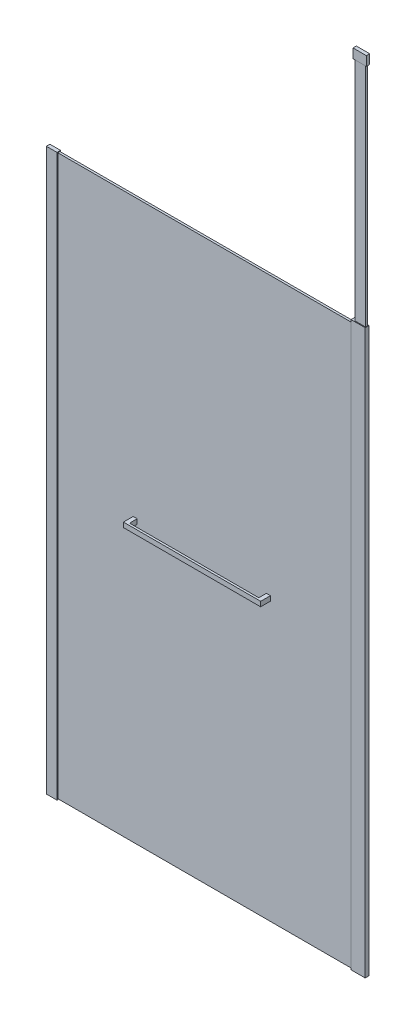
SolidWorks part; units mm, degrees
ref_plane "Płaszczyzna przednia" through (0, 0, 0) normal (0, 0, 1) x (1, 0, 0)
ref_plane "Płaszczyzna górna" through (0, 0, 0) normal (0, 1, 0) x (1, 0, 0)
ref_plane "Płaszczyzna prawa" through (0, 0, 0) normal (1, 0, 0) x (0, 0, -1)
sketch "Szkic1" plane through (0, 0, 0) normal (0, 1, 0) x (1, 0, 0)
  line L0 (0, 0) -> (0, 13.3)
  line L1 (0, 13.3) -> (40, 13.3)
  line L2 (40, 13.3) -> (40, 11.4)
  line L3 (40, 11.4) -> (6.5, 11.4)
  line L4 (6.5, 11.4) -> (6.5, 3.4)
  line L5 (6.5, 3.4) -> (40, 3.4)
  line L6 (40, 3.4) -> (40, 0)
  line L7 (40, 0) -> (0, 0)
  dimension "D1" = 40
  dimension "D2" = 13.3
  dimension "D3" = 33.5
  dimension "D4" = 1.9
  dimension "D5" = 8
extrude "Dodanie-wyciągnięcie1" add sketch "Szkic1" along normal blind 2100 from offset 3
sketch "Szkic2" plane through (0, 3, 0) normal (0, -1, 0) x (1, 0, 0)
  line L0 (6.5, -11.4) -> (40, -11.4) construction
  line L1 (6.5, -3.4) -> (1153.5, -3.4)
  line L2 (6.5, -3.4) -> (6.5, -11.4)
  line L3 (6.5, -11.4) -> (1153.5, -11.4)
  line L4 (1153.5, -3.4) -> (1153.5, -11.4)
  dimension "D1" = 1147
extrude "Dodanie-wyciągnięcie2" add sketch "Szkic2" against normal blind 2100 separate body
sketch "Szkic3" plane through (0, 3, 0) normal (0, -1, 0) x (1, 0, 0)
  line L0 (1143.4, -3.4) -> (1143.4, -0.4)
  line L1 (1153.5, -3.4) -> (6.5, -3.4) construction
  line L2 (1143.4, -0.4) -> (1196.4, -0.4)
  line L3 (1196.4, -0.4) -> (1196.4, -14.4)
  line L4 (1196.4, -14.4) -> (1143.4, -14.4)
  line L5 (1143.4, -14.4) -> (1143.4, -11.4)
  line L6 (1143.4, -11.4) -> (1153.5, -11.4)
  line L7 (1153.5, -11.4) -> (1153.5, -3.4)
  line L8 (1153.5, -3.4) -> (1143.4, -3.4)
  line L9 (6.5, -11.4) -> (1153.5, -11.4) construction
  line L10 (1153.5, -11.4) -> (1153.5, -3.4) construction
  dimension "D1" = 10.1
  dimension "D2" = 3
  dimension "D3" = 3
  dimension "D4" = 53
extrude "Dodanie-wyciągnięcie3" add sketch "Szkic3" against normal blind 2108 separate body
sketch "Szkic4" plane through (0, 2103, 0) normal (0, 1, 0) x (1, 0, 0)
  line L1 (0, 13.3) -> (40, 13.3)
  line L2 (0, 13.3) -> (0, 0)
  line L3 (0, 0) -> (40, 0)
  line L4 (40, 13.3) -> (40, 0)
extrude "Dodanie-wyciągnięcie4" add sketch "Szkic4" along normal blind 3
sketch "Szkic5" plane through (0, 2111, 0) normal (0, 1, 0) x (1, 0, 0)
  line L1 (1196.4, 14.4) -> (1143.4, 14.4)
  line L2 (1196.4, 14.4) -> (1196.4, 0.4)
  line L3 (1196.4, 0.4) -> (1143.4, 0.4)
  line L4 (1143.4, 14.4) -> (1143.4, 0.4)
extrude "Dodanie-wyciągnięcie5" add sketch "Szkic5" along normal blind 3
sketch "Szkic6" plane through (1143.4, 0, 0) normal (-1, 0, 0) x (0, 0, 1)
  line L0 (-11.4, 2111) -> (-3.4, 2111) construction
  line L1 (-3.35, 2111) -> (-11.45, 2111)
  line L2 (-3.35, 2111) -> (-3.35, 2103.2)
  line L3 (-3.35, 2103.2) -> (-11.45, 2103.2)
  line L4 (-11.45, 2111) -> (-11.45, 2103.2)
  point P6 (-7.4, 2111)
  dimension "D1" = 8.1
  dimension "D2" = 7.8
extrude "Dodanie-wyciągnięcie6" add sketch "Szkic6" against normal blind 15
sketch "Szkic7" plane through (0, 3, 0) normal (0, -1, 0) x (1, 0, 0)
  line L1 (1143.4, -0.4) -> (1196.4, -0.4)
  line L2 (1143.4, -0.4) -> (1143.4, -14.4)
  line L3 (1143.4, -14.4) -> (1196.4, -14.4)
  line L4 (1196.4, -0.4) -> (1196.4, -14.4)
extrude "Dodanie-wyciągnięcie7" add sketch "Szkic7" along normal blind 3
sketch "Szkic8" plane through (0, 3, 0) normal (0, -1, 0) x (1, 0, 0)
  line L1 (0, 0) -> (40, 0)
  line L2 (0, 0) -> (0, -13.3)
  line L3 (0, -13.3) -> (40, -13.3)
  line L4 (40, 0) -> (40, -13.3)
extrude "Dodanie-wyciągnięcie8" add sketch "Szkic8" along normal blind 3
sketch "Szkic9" plane through (0, 2114, 2099.6) normal (0, -1, 0) x (-1, 0, 0)
  line L1 (-1194.9, 2111) -> (-1154.9, 2111)
  line L2 (-1194.9, 2111) -> (-1194.9, 2103)
  line L3 (-1194.9, 2103) -> (-1154.9, 2103)
  line L4 (-1154.9, 2111) -> (-1154.9, 2103)
  line L7 (-1143.4, 2114) -> (-1196.4, 2114) construction
  line L8 (-1196.4, 2114) -> (-1196.4, 2100) construction
  dimension "D1" = 3
  dimension "D2" = 1.5
  dimension "D3" = 8
  dimension "D4" = 40
extrude "Dodanie-wyciągnięcie9" add sketch "Szkic9" against normal blind 883 separate body
sketch "Szkic10" plane through (0, 2997, 0) normal (0, 1, 0) x (-1, 0, 0)
  line L0 (-1174.9, -11.4) -> (-1174.9, -7.4) construction
  line L1 (-1199.9, -1.15) -> (-1149.9, -1.15)
  line L2 (-1199.9, -1.15) -> (-1199.9, -13.65)
  line L3 (-1199.9, -13.65) -> (-1149.9, -13.65)
  line L4 (-1149.9, -1.15) -> (-1149.9, -13.65)
  line L5 (-1199.9, -1.15) -> (-1149.9, -13.65) construction
  line L6 (-1199.9, -13.65) -> (-1149.9, -1.15) construction
  line L7 (-1154.9, -11.4) -> (-1194.9, -11.4) construction
  line L8 (-1174.9, -7.4) -> (-1194.9, -7.4) construction
  line L9 (-1194.9, -11.4) -> (-1194.9, -3.4) construction
  point P0 (-1174.9, -7.4)
  dimension "D1" = 12.5
  dimension "D2" = 50
extrude "Dodanie-wyciągnięcie10" add sketch "Szkic10" along normal blind 35 from offset 32
ref_plane "Płaszczyzna1" through (1174.9, 0, 0) normal (1, 0, 0) x (0, 0, -1)
sketch "Szkic12" plane through (0, 0, -3.4) normal (0, 0, 1) x (1, 0, 0)
  line L0 (580, 1409.7928) -> (580, 762.3594) construction
  line L1 (330, 1053) -> (830, 1053) construction
  line L2 (6.5, 2103) -> (6.5, 3) construction
  line L3 (1153.5, 2103) -> (1153.5, 3) construction
  line L5 (322.5, 1062) -> (337.5, 1062)
  line L6 (322.5, 1062) -> (322.5, 1044)
  line L7 (322.5, 1044) -> (337.5, 1044)
  line L8 (337.5, 1062) -> (337.5, 1044)
  line L9 (322.5, 1062) -> (337.5, 1044) construction
  line L10 (322.5, 1044) -> (337.5, 1062) construction
  line L11 (822.5, 1062) -> (837.5, 1062)
  line L12 (822.5, 1062) -> (822.5, 1044)
  line L13 (822.5, 1044) -> (837.5, 1044)
  line L14 (837.5, 1062) -> (837.5, 1044)
  line L15 (822.5, 1062) -> (837.5, 1044) construction
  line L16 (822.5, 1044) -> (837.5, 1062) construction
  dimension "D1" = 1053
  dimension "D2" = 500
  dimension "D3" = 15
  dimension "D4" = 18
extrude "Dodanie-wyciągnięcie11" add sketch "Szkic12" along normal blind 36.5 and the other way blind 18 separate body
sketch "Szkic13" plane through (337.5, 0, 0) normal (1, 0, 0) x (0, 0, -1)
  line L0 (21.4, 1044) -> (-33.1, 1044) construction
  line L1 (-33.1, 1062) -> (-25.1, 1062)
  line L2 (-33.1, 1062) -> (-33.1, 1044)
  line L3 (-33.1, 1044) -> (-25.1, 1044)
  line L4 (-25.1, 1062) -> (-25.1, 1044)
  dimension "D1" = 8
extrude "Dodanie-wyciągnięcie12" add sketch "Szkic13" along normal up to surface (485 mm away)
